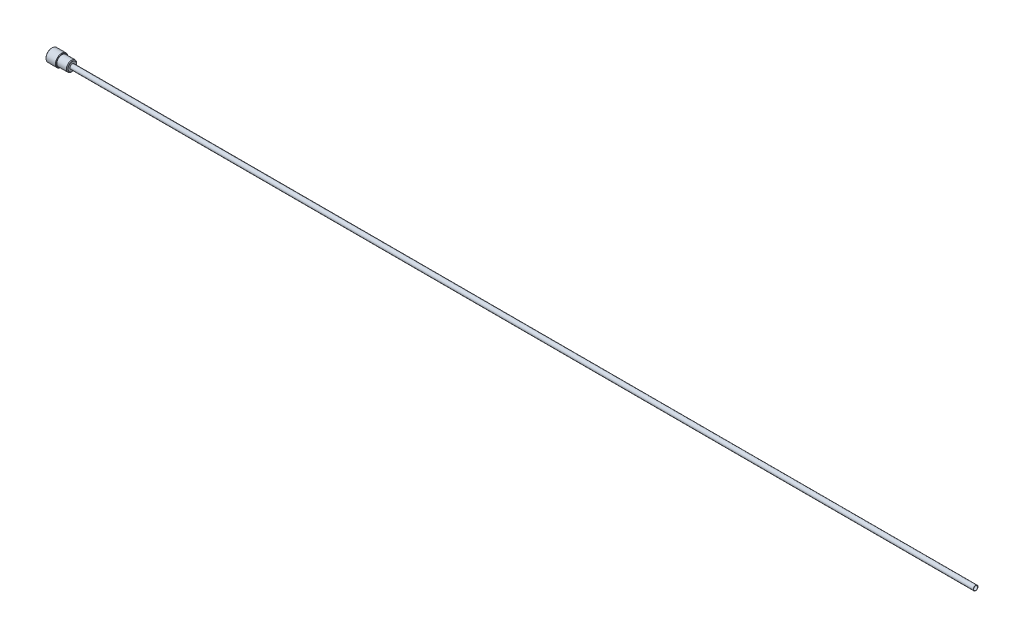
SolidWorks part; units mm, degrees
ref_plane "Front Plane" through (0, 0, 0) normal (0, 0, 1) x (1, 0, 0)
ref_plane "Top Plane" through (0, 0, 0) normal (0, 1, 0) x (1, 0, 0)
ref_plane "Right Plane" through (0, 0, 0) normal (1, 0, 0) x (0, 0, -1)
sketch "Sketch1" plane through (0, 0, 0) normal (0, 0, 1) x (1, 0, 0)
  line L1 (10, 2.05) -> (9.9, 2.05)
  line L2 (5, 2.5) -> (9.6402, 2.5)
  line L3 (5, 2.5) -> (5, 3)
  line L4 (10, 2.05) -> (10, 1.143)
  line L5 (10, 1.143) -> (450, 1.143)
  line L6 (450, 1.143) -> (450, 0.9652)
  line L7 (450, 0.9652) -> (0, 0.9652)
  line L8 (0, 0.9652) -> (0, 3)
  line L9 (-22.2122, 0) -> (63.2184, 0) construction
  line L10 (5, 3) -> (0, 3)
  line L11 (9.9, 2.05) -> (9.6402, 2.5)
  dimension "D2" = 5
  dimension "D1" = 6
  dimension "D3" = 10
  dimension "tube ID" = 1.9304
  dimension "D4" = 0.1
  dimension "D5" = 60
  dimension "D6" = 2.286
  dimension "D7" = 450
  dimension "D8" = 5
  dimension "D9" = 4.1
revolve "Revolve1" add sketch "Sketch1" angle 360 about L9
chamfer "Chamfer3" distance 0.2 angle 45 2 edges at (5, 0, 3) (0, 0, 3)
sketch "Sketch6" plane through (0, 0, 0) normal (0, 0, 1) x (1, 0, 0)
  line L0 (-11.6819, 0) -> (2.936, 0) construction
  line L1 (450, 0) -> (0, 0) construction
  line L2 (0, 0) -> (0, 2)
  line L4 (0, 2) -> (3, 2)
  line L5 (3, 2) -> (4.2017, 0)
  line L6 (4.2017, 0) -> (0, 0)
  dimension "D1" = 4
  dimension "D2" = 59
  dimension "D3" = 3
revolve "Cut-Revolve1" cut sketch "Sketch6" angle 360 about L0
chamfer "Chamfer2" distance 0.3 angle 45 1 edges at (0, 0, 2)
sketch "Sketch7" plane through (0, 0, 0) normal (-1, 0, 0) x (0, 0, 1)
  line L1 (-2.3094, 0) -> (-1.1547, -2)
  line L2 (-1.1547, -2) -> (1.1547, -2)
  line L3 (1.1547, -2) -> (2.3094, 0)
  line L4 (2.3094, 0) -> (1.1547, 2)
  line L5 (1.1547, 2) -> (-1.1547, 2)
  line L6 (-1.1547, 2) -> (-2.3094, 0)
  circle A0 centre (0, 0) radius 2 construction
  circle A1 centre (0, 0) radius 2 construction
extrude "Cut-Extrude1" cut sketch "Sketch7" against normal up to surface (2.8141 mm away)
